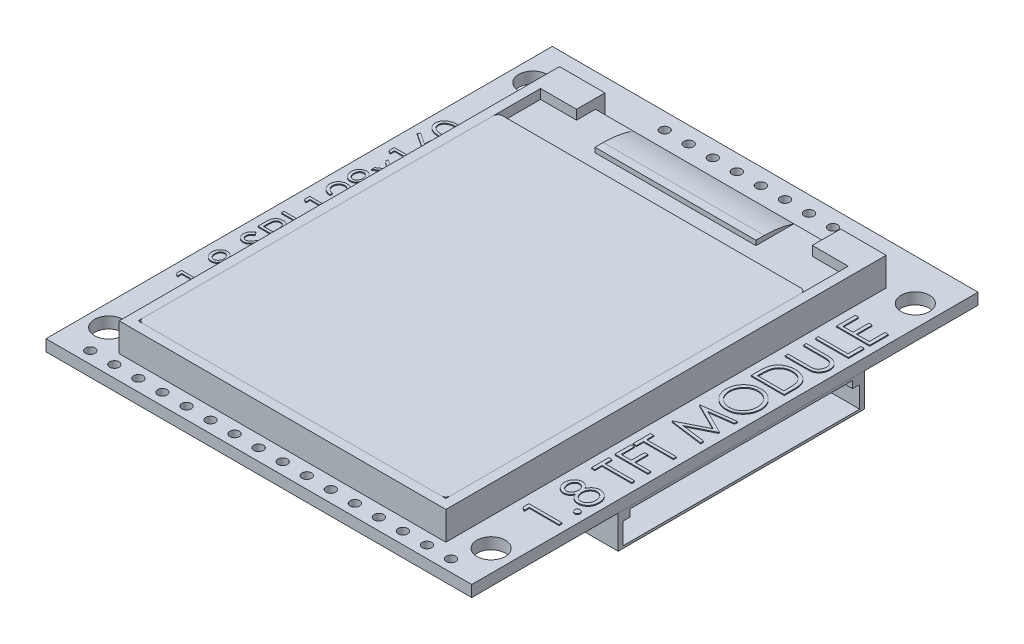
SolidWorks part; units mm, degrees
ref_plane "Piano frontale" through (0, 0, 0) normal (0, 0, 1) x (1, 0, 0)
ref_plane "Piano superiore" through (0, 0, 0) normal (0, 1, 0) x (1, 0, 0)
ref_plane "Piano destro" through (0, 0, 0) normal (1, 0, 0) x (0, 0, -1)
sketch "Schizzo1" plane through (0, 0, 0) normal (0, 1, 0) x (1, 0, 0)
  line L0 (-8.89, 25.015) -> (-6.35, 25.015) construction
  line L1 (-22.48, -26.735) -> (22.48, -26.735)
  line L2 (-22.48, -26.735) -> (-22.48, 26.735)
  line L3 (-22.48, 26.735) -> (22.48, 26.735)
  line L4 (22.48, -26.735) -> (22.48, 26.735)
  line L5 (-22.48, -26.735) -> (22.48, 26.735) construction
  line L6 (-22.48, 26.735) -> (22.48, -26.735) construction
  line L7 (-20.195, -22.4) -> (20.195, -22.4) construction
  line L8 (-20.195, -22.4) -> (-20.195, 22.4) construction
  line L9 (-20.195, 22.4) -> (20.195, 22.4) construction
  line L10 (20.195, -22.4) -> (20.195, 22.4) construction
  line L11 (-20.195, -22.4) -> (20.195, 22.4) construction
  line L12 (-20.195, 22.4) -> (20.195, -22.4) construction
  line L13 (-6.35, 25.015) -> (-3.81, 25.015) construction
  line L14 (-3.81, 25.015) -> (-1.27, 25.015) construction
  line L15 (-1.27, 25.015) -> (1.27, 25.015) construction
  line L16 (1.27, 25.015) -> (3.81, 25.015) construction
  line L17 (3.81, 25.015) -> (6.35, 25.015) construction
  line L18 (6.35, 25.015) -> (8.89, 25.015) construction
  line L19 (-19.05, -25.485) -> (-16.51, -25.485) construction
  line L20 (-16.51, -25.485) -> (-13.97, -25.485) construction
  line L21 (-13.97, -25.485) -> (-11.43, -25.485) construction
  line L22 (-11.43, -25.485) -> (-8.89, -25.485) construction
  line L23 (-8.89, -25.485) -> (-6.35, -25.485) construction
  line L24 (-6.35, -25.485) -> (-3.81, -25.485) construction
  line L25 (-3.81, -25.485) -> (-1.27, -25.485) construction
  line L26 (-1.27, -25.485) -> (1.27, -25.485) construction
  line L27 (1.27, -25.485) -> (3.81, -25.485) construction
  line L28 (3.81, -25.485) -> (6.35, -25.485) construction
  line L29 (6.35, -25.485) -> (8.89, -25.485) construction
  line L30 (8.89, -25.485) -> (11.43, -25.485) construction
  line L31 (11.43, -25.485) -> (13.97, -25.485) construction
  line L32 (13.97, -25.485) -> (16.51, -25.485) construction
  line L33 (16.51, -25.485) -> (19.05, -25.485) construction
  line L34 (0, 0) -> (0, -25.485) construction
  line L35 (0, 0) -> (0, 25.015) construction
  circle A0 centre (-20.195, 22.4) radius 1.5
  circle A1 centre (20.195, 22.4) radius 1.5
  circle A2 centre (20.195, -22.4) radius 1.5
  circle A3 centre (-20.195, -22.4) radius 1.5
  circle A4 centre (-19.05, -25.485) radius 0.5
  circle A5 centre (-16.51, -25.485) radius 0.5
  circle A6 centre (-13.97, -25.485) radius 0.5
  circle A7 centre (-11.43, -25.485) radius 0.5
  circle A8 centre (-8.89, -25.485) radius 0.5
  circle A9 centre (-6.35, -25.485) radius 0.5
  circle A10 centre (-3.81, -25.485) radius 0.5
  circle A11 centre (-1.27, -25.485) radius 0.5
  circle A12 centre (-8.89, 25.015) radius 0.5
  circle A13 centre (1.27, -25.485) radius 0.5
  circle A14 centre (3.81, -25.485) radius 0.5
  circle A15 centre (6.35, -25.485) radius 0.5
  circle A16 centre (8.89, -25.485) radius 0.5
  circle A17 centre (11.43, -25.485) radius 0.5
  circle A18 centre (13.97, -25.485) radius 0.5
  circle A19 centre (16.51, -25.485) radius 0.5
  circle A20 centre (19.05, -25.485) radius 0.5
  circle A21 centre (-6.35, 25.015) radius 0.5
  circle A22 centre (-3.81, 25.015) radius 0.5
  circle A23 centre (8.89, 25.015) radius 0.5
  circle A24 centre (6.35, 25.015) radius 0.5
  circle A25 centre (3.81, 25.015) radius 0.5
  circle A26 centre (1.27, 25.015) radius 0.5
  circle A27 centre (-1.27, 25.015) radius 0.5
  point P0 (0, 0)
  point P6 (0, 0)
  dimension "D5" = 3
  dimension "D7" = 1
  dimension "D10" = 1
  dimension "D1" = 44.96
  dimension "D2" = 53.47
  dimension "D3" = 40.39
  dimension "D4" = 44.8
  dimension "D6" = 2.54
  dimension "D8" = 50.5
  dimension "D9" = 1.25
extrude "Estrusione-Estrusione1" add sketch "Schizzo1" along normal blind 1.2
sketch "Schizzo2" plane through (0, 1.2, 0) normal (0, 1, 0) x (1, 0, 0)
  line L0 (-22.48, -26.735) -> (22.48, -26.735) construction
  line L1 (17.25, 22.265) -> (-17.25, 22.265)
  line L2 (17.25, 22.265) -> (17.25, -24.235)
  line L3 (17.25, -24.235) -> (-17.25, -24.235)
  line L4 (-17.25, 22.265) -> (-17.25, -24.235)
  line L5 (-22.48, 0) -> (-17.25, 0) construction
  line L6 (-22.48, 26.735) -> (-22.48, -26.735) construction
  line L8 (17.25, 0) -> (22.48, 0) construction
  line L9 (22.48, -26.735) -> (22.48, 26.735) construction
  dimension "D1" = 46.5
  dimension "D2" = 34.5
  dimension "D3" = 2.5
extrude "Estrusione-Estrusione2" add sketch "Schizzo2" along normal blind 3 separate body
sketch "Schizzo3" plane through (0, 4.2, 0) normal (0, 1, 0) x (1, 0, 0)
  line L0 (-12.45, 22.265) -> (-12.45, 19.265)
  line L1 (17.25, 22.265) -> (-17.25, 22.265) construction
  line L2 (-12.45, 19.265) -> (-16.25, 19.265)
  line L3 (-16.25, 19.265) -> (-16.25, -23.235)
  line L4 (-16.25, -23.235) -> (16.25, -23.235)
  line L5 (16.25, -23.235) -> (16.25, 19.265)
  line L6 (16.25, 19.265) -> (12.45, 19.265)
  line L7 (12.45, 19.265) -> (12.45, 22.265)
  line L8 (12.45, 22.265) -> (-12.45, 22.265)
  line L9 (0, -24.235) -> (0, -23.235) construction
  line L10 (-17.25, -24.235) -> (17.25, -24.235) construction
  line L11 (17.25, -24.235) -> (17.25, 22.265) construction
  dimension "D1" = 1
  dimension "D2" = 1
  dimension "D3" = 3
  dimension "D4" = 4.8
extrude "Taglio-Estrusione1" cut sketch "Schizzo3" against normal blind 3
sketch "Schizzo4" plane through (0, 1.2, 0) normal (0, 1, 0) x (1, 0, 0)
  line L0 (12.45, 21.265) -> (-12.45, 21.265)
  line L1 (-12.45, 21.265) -> (-12.45, 19.265)
  line L2 (-12.45, 19.265) -> (-16.25, 19.265)
  line L3 (-16.25, 19.265) -> (-16.25, -23.235)
  line L4 (-16.25, -23.235) -> (16.25, -23.235)
  line L5 (16.25, -23.235) -> (16.25, 19.265)
  line L6 (16.25, 19.265) -> (12.45, 19.265)
  line L7 (12.45, 19.265) -> (12.45, 21.265)
  line L8 (-12.45, 22.265) -> (-12.45, 19.265) construction
  line L9 (-12.45, 19.265) -> (-16.25, 19.265) construction
  dimension "D1" = 1
extrude "Estrusione-Estrusione3" add sketch "Schizzo4" along normal blind 2 separate body
sketch "Schizzo5" plane through (0, 3.2, 0) normal (0, 1, 0) x (1, 0, 0)
  line L0 (16.25, -23.235) -> (16.25, 19.265) construction
  line L1 (-15.75, -23.235) -> (15.75, -23.235)
  line L2 (-16.25, -22.735) -> (-16.25, 14.265)
  line L3 (-15.75, 14.765) -> (15.75, 14.765)
  line L4 (16.25, -22.735) -> (16.25, 14.265)
  arc A0 (-15.75, -23.235) -> (-16.25, -22.735) centre (-15.75, -22.735) cw
  arc A1 (15.75, -23.235) -> (16.25, -22.735) centre (15.75, -22.735) ccw
  arc A2 (15.75, 14.765) -> (16.25, 14.265) centre (15.75, 14.265) cw
  arc A3 (-16.25, 14.265) -> (-15.75, 14.765) centre (-15.75, 14.265) cw
  point P9 (-16.25, -23.235)
  point P12 (16.25, -23.235)
  point P15 (16.25, 14.765)
  dimension "D2" = 0.5
  dimension "D1" = 38
extrude "Estrusione-Estrusione4" add sketch "Schizzo5" along normal blind 1 separate body
sketch "Schizzo6" plane through (0, 3.2, 0) normal (0, 1, 0) x (1, 0, 0)
  line L0 (12.45, 21.265) -> (-12.45, 21.265) construction
  line L1 (-8.5, 21.265) -> (8.5, 21.265)
  line L2 (-8.5, 21.265) -> (-8.5, 17.265)
  line L3 (-8.5, 17.265) -> (8.5, 17.265)
  line L4 (8.5, 21.265) -> (8.5, 17.265)
  line L5 (0, 17.265) -> (0, 21.265) construction
  dimension "D1" = 4
  dimension "D2" = 17
extrude "Estrusione-Estrusione5" add sketch "Schizzo6" along normal blind 0.5 separate body
fillet "Raccordo1" radius 10 1 edges at (0, 3.7, -21.265)
sketch "Schizzo7" plane through (0, 1.2, 0) normal (0, 1, 0) x (1, 0, 0)
  line L0 (-18.48, -26.735) -> (-18.48, 26.735) construction
  line L1 (-22.48, -26.735) -> (22.48, -26.735) construction
  line L2 (22.48, 26.735) -> (-22.48, 26.735) construction
  line L3 (-22.48, 26.735) -> (-22.48, -26.735) construction
  text T0 "1.8 SPI 128x160" font "Century Gothic" height 3
  dimension "D1" = 4
extrude "Estrusione-Estrusione6" add sketch "Schizzo7" along normal blind 0.1 separate body
sketch "Schizzo8" plane through (0, 1.2, 0) normal (0, 1, 0) x (1, 0, 0)
  line L0 (21.7123, -26.735) -> (21.7123, 26.735) construction
  line L1 (-22.48, -26.735) -> (22.48, -26.735) construction
  line L2 (22.48, 26.735) -> (-22.48, 26.735) construction
  text T0 "1.8 TFT MODULE"
extrude "Estrusione-Estrusione7" add sketch "Schizzo8" along normal blind 0.1 separate body
sketch "Schizzo9" plane through (0, 0, 0) normal (0, -1, 0) x (1, 0, 0)
  line L0 (22.48, 26.735) -> (22.48, -26.735) construction
  line L1 (22.48, -14.735) -> (4.98, -14.735)
  line L2 (22.48, -14.735) -> (22.48, 11.265)
  line L3 (22.48, 11.265) -> (12.48, 11.265)
  line L4 (4.98, -14.735) -> (4.98, 9.265)
  line L5 (22.48, -26.735) -> (-22.48, -26.735) construction
  line L6 (4.98, 9.265) -> (10.98, 9.265)
  line L7 (10.98, 9.265) -> (12.48, 11.265)
  line L8 (4.98, 9.265) -> (4.98, 11.265) construction
  line L9 (12.48, 11.265) -> (4.98, 11.265) construction
  dimension "D1" = 12
  dimension "D2" = 38
  dimension "D3" = 17.5
  dimension "D4" = 6
  dimension "D5" = 7.5
  dimension "D6" = 2
extrude "Estrusione-Estrusione8" add sketch "Schizzo9" along normal blind 3.5 separate body
sketch "Schizzo10" plane through (22.48, 0, 0) normal (1, 0, 0) x (0, 0, -1)
  line L0 (-10.765, -3.25) -> (14.235, -3.25)
  line L1 (14.235, -3.25) -> (14.235, -1)
  line L2 (14.235, -1) -> (13.485, -1)
  line L3 (13.485, -1) -> (13.485, -0.25)
  line L4 (13.485, -0.25) -> (-10.015, -0.25)
  line L5 (-10.015, -0.25) -> (-10.015, -1)
  line L6 (-10.015, -1) -> (-10.765, -1)
  line L7 (-10.765, -1) -> (-10.765, -3.25)
  line L8 (14.735, -3.5) -> (-11.265, -3.5) construction
  line L9 (1.735, -3.25) -> (1.735, -0.25) construction
  line L10 (1.735, -0.25) -> (1.735, 0) construction
  line L11 (14.735, 0) -> (-11.265, 0) construction
  line L12 (-26.735, 0) -> (26.735, 0) construction
  line L13 (-11.265, -3.5) -> (-11.265, 0) construction
  dimension "D1" = 0.25
  dimension "D2" = 0.25
  dimension "D3" = 0.5
  dimension "D4" = 0.75
  dimension "D5" = 0.75
extrude "Taglio-Estrusione2" cut sketch "Schizzo10" against normal blind 17
